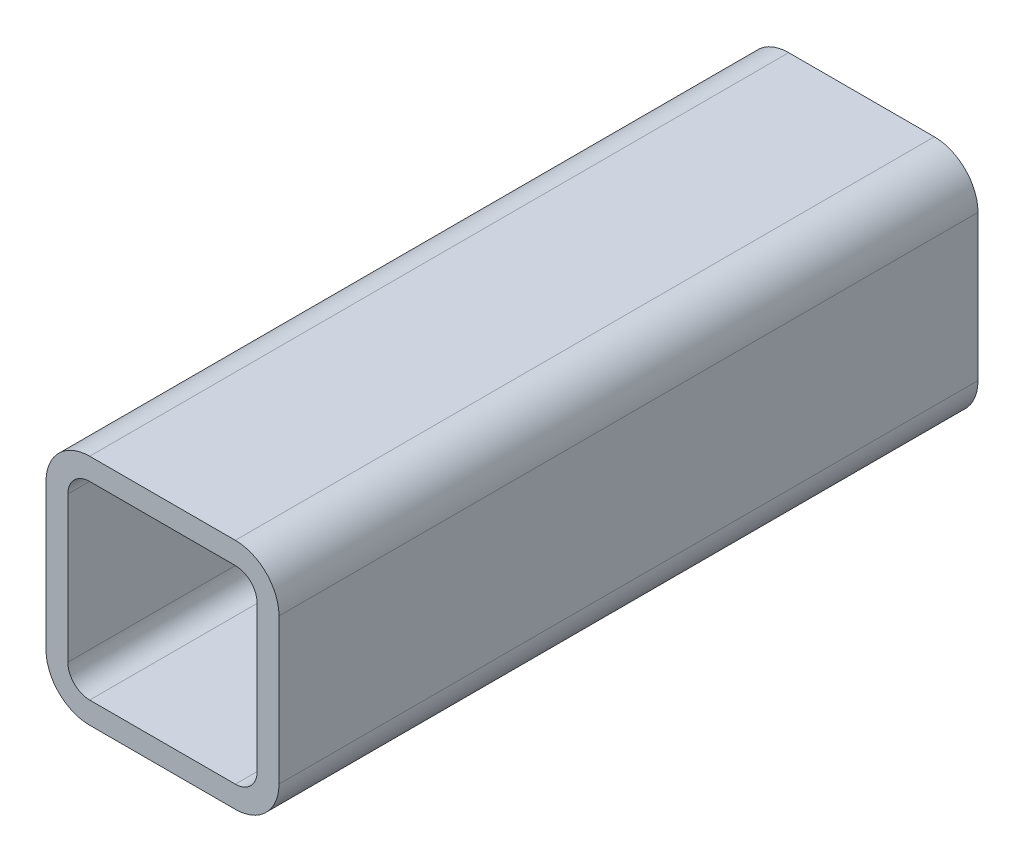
SolidWorks part; units mm, degrees
ref_plane "Front Plane" through (0, 0, 0) normal (0, 0, 1) x (1, 0, 0)
ref_plane "Top Plane" through (0, 0, 0) normal (0, 1, 0) x (1, 0, 0)
ref_plane "Right Plane" through (0, 0, 0) normal (1, 0, 0) x (0, 0, -1)
sketch "Sketch1" plane through (0, 0, 0) normal (0, 0, 1) x (1, 0, 0)
sketch_block_instance "HSS4x4x0.375-1"
sketch_block "HSS4x4x0.375"
extrude "Boss-Extrude1" add sketch "Sketch1" along normal blind 304.8
